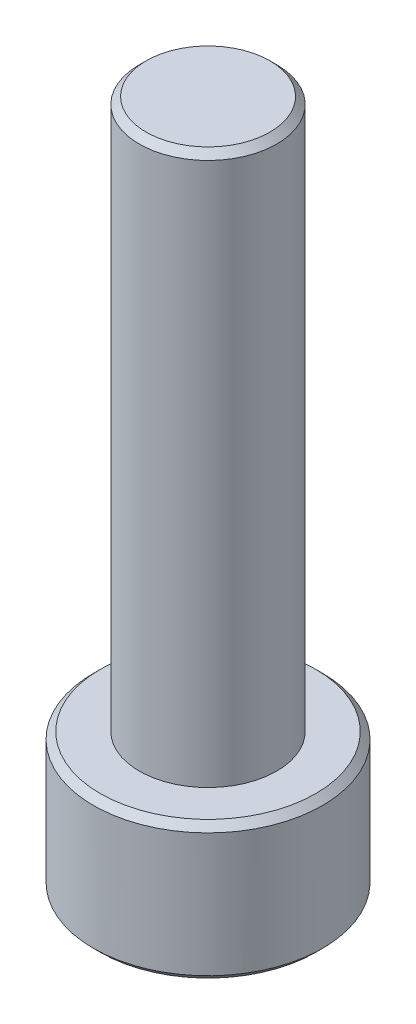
SolidWorks part; units mm, degrees
ref_plane "Front" through (0, 0, 0) normal (0, 0, 1) x (1, 0, 0)
ref_plane "Top" through (0, 0, 0) normal (0, 1, 0) x (1, 0, 0)
ref_plane "Right" through (0, 0, 0) normal (1, 0, 0) x (0, 0, -1)
sketch "Sketch1" plane through (0, 0, 0) normal (0, 1, 0) x (1, 0, 0)
  circle A0 centre (0, 0) radius 5
  dimension "D1" = 10
extrude "Boss-Extrude1" add sketch "Sketch1" along normal blind 6
sketch "Sketch2" plane through (0, 6, 0) normal (0, 1, 0) x (1, 0, 0)
  circle A0 centre (0, 0) radius 3
  dimension "D1" = 6
extrude "Boss-Extrude2" add sketch "Sketch2" along normal blind 24
chamfer "Chamfer1" distance 0.3 angle 45 2 edges at (0, 0, 5) (0, 6, 5)
chamfer "Chamfer2" distance 0.3 angle 45 1 edges at (0, 30, 3)
sketch "Sketch3" plane through (0, 0, 0) normal (0, -1, 0) x (1, 0, 0)
  line L1 (2.8868, 0) -> (1.4434, 2.5)
  line L2 (1.4434, 2.5) -> (-1.4434, 2.5)
  line L3 (-1.4434, 2.5) -> (-2.8868, 0)
  line L4 (-2.8868, 0) -> (-1.4434, -2.5)
  line L5 (-1.4434, -2.5) -> (1.4434, -2.5)
  line L6 (1.4434, -2.5) -> (2.8868, 0)
  circle A0 centre (0, 0) radius 2.5 construction
  dimension "D1" = 5
extrude "Cut-Extrude1" cut sketch "Sketch3" against normal blind 3
